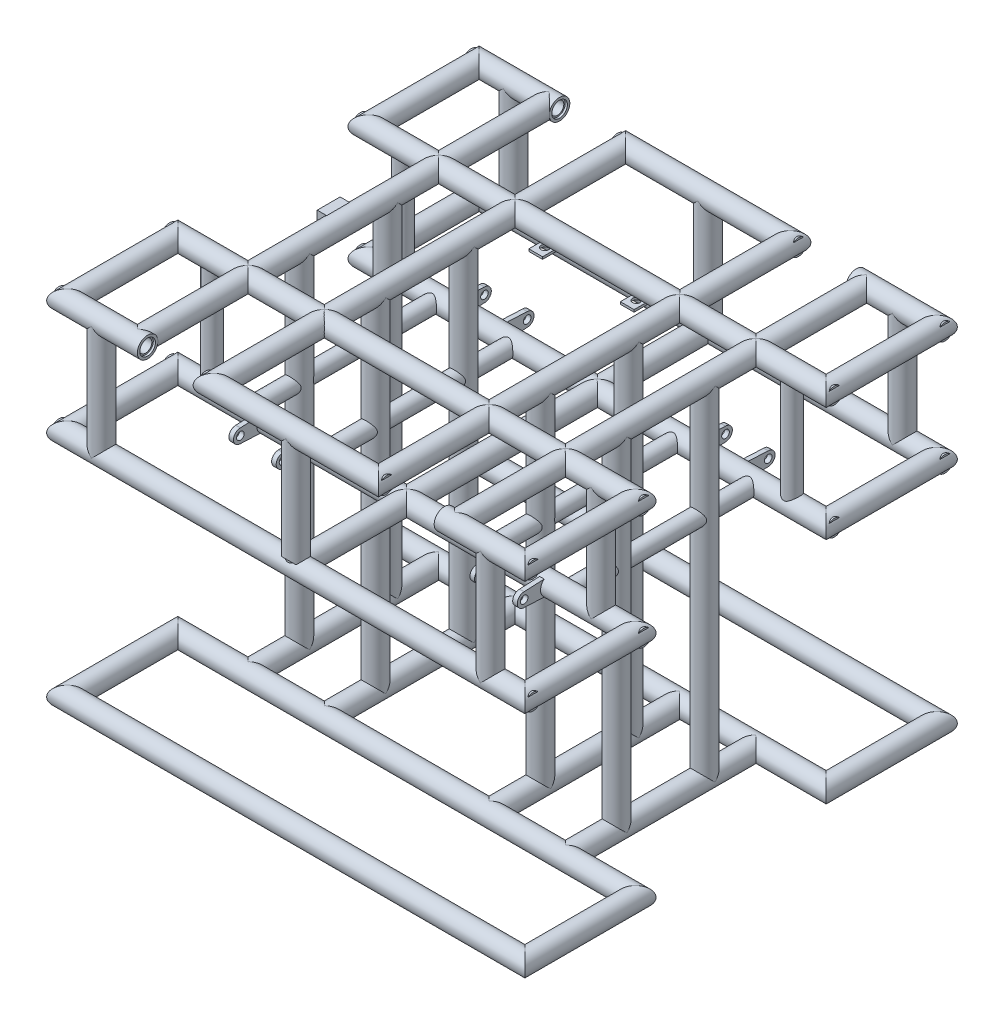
SolidWorks part; units mm, degrees
ref_plane "Front Plane" through (0, 0, 0) normal (0, 0, 1) x (1, 0, 0)
ref_plane "Top Plane" through (0, 0, 0) normal (0, 1, 0) x (1, 0, 0)
ref_plane "Right Plane" through (0, 0, 0) normal (1, 0, 0) x (0, 0, -1)
sketch "Sketch1" plane through (0, 0, 0) normal (0, 1, 0) x (1, 0, 0)
  line L0 (-232.2406, 270) -> (367.7594, 270)
  line L1 (367.7594, 270) -> (367.7594, 125)
  line L2 (367.7594, 125) -> (-232.2406, 125)
  line L3 (-232.2406, 125) -> (-232.2406, 270)
  line L4 (-40.2406, 125) -> (-40.2406, -125)
  line L5 (-324.3697, 0) -> (547.8992, 0) construction
  line L6 (367.7594, -270) -> (367.7594, -125)
  line L7 (367.7594, -125) -> (-232.2406, -125)
  line L8 (-232.2406, -270) -> (367.7594, -270)
  line L9 (-232.2406, -125) -> (-232.2406, -270)
  line L10 (-140.2406, 125) -> (-140.2406, -125)
  line L11 (67.7594, 270) -> (67.7594, -270)
  line L12 (67.7594, 292.9125) -> (67.7594, -328.4913) construction
  line L13 (175.7594, 125) -> (175.7594, -125)
  line L14 (275.7594, 125) -> (275.7594, -125)
  point P6 (-40.2406, 0)
  point P25 (67.7594, 0)
  dimension "D1" = 600
  dimension "D2" = 540
  dimension "D3" = 250
  dimension "D4" = 100
  dimension "D5" = 92
  dimension "D6" = 92
ref_plane "Plane2" through (0, 150, 0) normal (0, 1, 0) x (1, 0, 0)
sketch "Sketch41" plane through (0, 150, 0) normal (0, 1, 0) x (1, 0, 0)
  line L0 (-232.2406, 197.5) -> (367.7594, 197.5) construction
  line L1 (67.7594, 296.3558) -> (67.7594, -365.801) construction
  line L2 (-140.2406, 270) -> (-140.2406, -270)
  line L3 (-40.2406, 270) -> (-40.2406, -270)
  line L4 (367.7594, -270) -> (367.7594, -125)
  line L5 (367.7594, -125) -> (-232.2406, -125)
  line L6 (-232.2406, -125) -> (-232.2406, -270)
  line L7 (-232.2406, -270) -> (367.7594, -270)
  line L8 (367.7594, -270) -> (367.7594, -125)
  line L9 (367.7594, -125) -> (-232.2406, -125)
  line L10 (-232.2406, -125) -> (-232.2406, -270)
  line L11 (-232.2406, -270) -> (-140.2406, -270)
  line L12 (367.7594, 270) -> (-232.2406, 270)
  line L13 (367.7594, 125) -> (367.7594, 270)
  line L14 (-232.2406, 125) -> (367.7594, 125)
  line L15 (-232.2406, 270) -> (-232.2406, 125)
  line L16 (367.7594, 270) -> (275.7594, 270)
  line L17 (367.7594, 125) -> (367.7594, 270)
  line L19 (-232.2406, 270) -> (-232.2406, 125)
  line L20 (275.7594, 270) -> (275.7594, -270)
  line L21 (175.7594, 270) -> (175.7594, -270)
  line L22 (-140.2406, 270) -> (-232.2406, 270)
  line L23 (-232.2406, 125) -> (367.7594, 125)
  line L24 (-140.2406, 125) -> (-140.2406, -125) construction
  line L25 (-40.2406, -270) -> (175.7594, -270)
  line L26 (275.7594, -270) -> (367.7594, -270)
  line L27 (175.7594, 270) -> (-40.2406, 270)
  line L28 (175.7594, 125) -> (175.7594, -125) construction
  line L29 (67.7594, 270) -> (67.7594, -270)
  dimension "D3" = 100
  dimension "D1" = 0
  dimension "D2" = 0
ref_plane "Plane12" through (67.7594, 0, 0) normal (1, 0, 0) x (0, 0, -1)
ref_plane "Plane16" through (0, -300, 0) normal (0, 1, 0) x (1, 0, 0)
sketch "Sketch46" plane through (0, -300, 0) normal (0, 1, 0) x (1, 0, 0)
  line L0 (-140.2406, 125) -> (-140.2406, -125) construction
  line L1 (-40.2406, 125) -> (-40.2406, -125) construction
  line L2 (275.7594, 125) -> (275.7594, -125) construction
  line L3 (175.7594, 125) -> (175.7594, -125) construction
  line L4 (367.7594, -270) -> (367.7594, -125)
  line L5 (367.7594, -125) -> (-232.2406, -125)
  line L6 (-232.2406, -125) -> (-232.2406, -270)
  line L7 (-232.2406, -270) -> (367.7594, -270)
  line L8 (367.7594, -270) -> (367.7594, -125)
  line L9 (367.7594, -125) -> (-232.2406, -125)
  line L10 (-232.2406, -125) -> (-232.2406, -270)
  line L11 (-232.2406, -270) -> (367.7594, -270)
  line L12 (367.7594, 270) -> (-232.2406, 270)
  line L13 (367.7594, 125) -> (367.7594, 270)
  line L14 (-232.2406, 125) -> (367.7594, 125)
  line L15 (-232.2406, 270) -> (-232.2406, 125)
  line L16 (367.7594, 270) -> (-232.2406, 270)
  line L17 (367.7594, 125) -> (367.7594, 270)
  line L18 (-232.2406, 125) -> (367.7594, 125)
  line L19 (-232.2406, 270) -> (-232.2406, 125)
  line L20 (-140.2406, 125) -> (-140.2406, -125)
  line L21 (-40.2406, 125) -> (-40.2406, -125)
  line L22 (275.7594, 125) -> (275.7594, -125)
  line L23 (175.7594, 125) -> (175.7594, -125)
  dimension "D1" = 0
  dimension "D2" = 0
sketch3d "3DSketch1"
  line L2 (-140.2406, 150, -57.7625) -> (-140.2406, -300, -57.7625)
  line L4 (-187.2406, 0, -270) -> (-187.2406, 150, -270)
  line L5 (-232.2406, 0, -270) -> (367.7594, 0, -270) construction
  line L6 (-187.2406, 0, -125) -> (-187.2406, 150, -125)
  line L7 (367.7594, 0, -125) -> (-232.2406, 0, -125) construction
  line L8 (322.7594, 0, -270) -> (322.7594, 150, -270)
  line L9 (322.7594, 0, -125) -> (322.7594, 150, -125)
  line L10 (322.7594, 0, 270) -> (322.7594, 150, 270)
  line L11 (-187.2406, 0, 270) -> (-187.2406, 150, 270)
  line L12 (-187.2406, 0, 125) -> (-187.2406, 150, 125)
  line L13 (-140.2406, 150, 57.7625) -> (-140.2406, -300, 57.7625)
  line L14 (-40.2406, 150, 57.7625) -> (-40.2406, -300, 57.7625)
  line L15 (322.7594, 0, 125) -> (322.7594, 150, 125)
  line L16 (67.7594, 0, -270) -> (67.7594, 150, -270)
  line L17 (67.7594, 0, 270) -> (67.7594, 150, 270)
  line L18 (-232.2406, 0, 270) -> (367.7594, 0, 270) construction
  line L19 (175.7594, 150, -270) -> (-40.2406, 150, -270) construction
  line L20 (-140.2406, 150, -270) -> (-140.2406, 150, 270) construction
  line L21 (-40.2406, 150, 270) -> (175.7594, 150, 270) construction
  line L22 (275.7594, 150, -57.7625) -> (275.7594, -300, -57.7625)
  line L23 (275.7594, 150, 57.7625) -> (275.7594, -300, 57.7625)
  line L24 (175.7594, 150, 57.7625) -> (175.7594, -300, 57.7625)
  line L25 (175.7594, 150, -57.7625) -> (175.7594, -300, -57.7625)
  line L26 (-140.2406, -300, -125) -> (-140.2406, -300, 125) construction
  line L27 (-40.2406, 150, -270) -> (-40.2406, 150, 270) construction
  line L28 (-40.2406, -300, -125) -> (-40.2406, -300, 125) construction
  line L29 (-40.2406, 150, -57.7625) -> (-40.2406, -300, -57.7625)
  line L31 (175.7594, 150, -270) -> (175.7594, 150, 270) construction
  line L32 (175.7594, -300, -125) -> (175.7594, -300, 125) construction
  line L33 (275.7594, 150, -270) -> (275.7594, 150, 270) construction
  line L34 (275.7594, -300, -125) -> (275.7594, -300, 125) construction
  dimension "D1" = 510
  dimension "D2" = 45
other "Circular tube 21.3 X 2.3(1)"
ref_plane "Plane9" through (-232.2406, 0, -270) normal (1, 0, 0) x (0, 0, -1)
sketch "Sketch19" plane through (-232.2406, 0, -270) normal (1, 0, 0) x (0, 0, -1)
  circle A0 centre (0, 0) radius 8.35
  circle A1 centre (0, 0) radius 10.65
  point P3 (0, 0)
  dimension "In_dia" = 16.7
  dimension "Out_dia" = 21.3
other "Circular tube 26.9 X 3.2(1)"
ref_plane "Plane24" through (367.7594, -300, 125) normal (-1, 0, 0) x (0, 0, 1)
sketch "Sketch114" plane through (367.7594, -300, 125) normal (-1, 0, 0) x (0, 0, 1)
  circle A0 centre (0, 0) radius 10.25
  circle A1 centre (0, 0) radius 13.45
  point P3 (0, 0)
  point P5 (0, 0)
  point P6 (0, 0)
  dimension "In_dia" = 20.5
  dimension "Out_dia" = 26.9
ref_plane "Plane14" through (0, 0, -125) normal (0, 0, 1) x (1, 0, 0)
ref_plane "Plane15" through (0, 0, 125) normal (0, 0, 1) x (1, 0, 0)
ref_plane "Plane17" through (275.7594, 0, 0) normal (1, 0, 0) x (0, 0, -1)
sketch "Sketch48" plane through (0, 0, 0) normal (0, 1, 0) x (1, 0, 0)
  line L0 (175.7594, 125) -> (275.7594, 125) construction
  point P6 (250.7594, 125)
  point P7 (200.7594, 125)
  point P8 (225.7594, 125)
  dimension "D1" = 25
  dimension "D2" = 25
ref_plane "Plane18" through (250.7594, 0, 0) normal (1, 0, 0) x (0, 0, -1)
ref_plane "Plane19" through (200.7594, 0, 0) normal (1, 0, 0) x (0, 0, -1)
sketch "Sketch50" plane through (250.7594, 0, 0) normal (1, 0, 0) x (0, 0, -1)
  line L0 (125, 10.65) -> (160, 9)
  line L1 (125, -10.65) -> (160, -9)
  line L2 (125, 10.65) -> (125, 8.35)
  line L3 (125, 0) -> (125, 150) construction
  line L4 (125, -10.65) -> (125, -8.35)
  circle A0 centre (160, 0) radius 5
  arc A1 (160, -9) -> (160, 9) centre (160, 0) ccw
  arc A2 (125, -10.65) -> (125, 10.65) centre (125, 0) ccw construction
  circle A3 centre (125, 0) radius 8.35 construction
  arc A4 (125, 8.35) -> (125, -8.35) centre (125, 0) cw
  dimension "D1" = 18
extrude "Boss-Extrude3" add sketch "Sketch50" along normal blind 6 separate body
sketch "Sketch51" plane through (200.7594, 0, 0) normal (1, 0, 0) x (0, 0, -1)
  line L4 (125, 10.65) -> (125, 8.35)
  line L5 (160, 9) -> (125, 10.65)
  line L6 (125, -10.65) -> (160, -9)
  line L7 (125, -8.35) -> (125, -10.65)
  line L8 (125, 10.65) -> (125, 8.35)
  line L9 (160, 9) -> (125, 10.65)
  line L10 (125, -10.65) -> (160, -9)
  line L11 (125, -8.35) -> (125, -10.65)
  circle A0 centre (160, 0) radius 5
  arc A2 (160, -9) -> (160, 9) centre (160, 0) ccw
  arc A3 (125, -8.35) -> (125, 8.35) centre (125, 0) ccw
  arc A4 (160, -9) -> (160, 9) centre (160, 0) ccw
  arc A5 (125, -8.35) -> (125, 8.35) centre (125, 0) ccw
  dimension "D2" = 10
  dimension "D1" = 0
extrude "Boss-Extrude4" add sketch "Sketch51" against normal blind 6 separate body contours A5 L11 L10 A4 L9 L8 A0
mirror "Mirror1" about plane through (0, 0, 0) normal (0, 0, 1) of "Boss-Extrude3", "Boss-Extrude4"
ref_plane "Plane20" through (67.7594, 0, 0) normal (1, 0, 0) x (0, 0, -1)
mirror "Mirror2" about plane through (67.7594, 0, 0) normal (1, 0, 0) of "Boss-Extrude3", "Boss-Extrude4", "Mirror1"
ref_plane "Plane21" through (6.9325, 0, 0) normal (1, 0, 0) x (0, 0, -1)
sketch "Sketch52" plane through (6.9325, 0, 0) normal (1, 0, 0) x (0, 0, -1)
  line L1 (126, 133.3407) -> (133.6144, 143.7379)
  line L3 (125.0853, 139.3503) -> (122.8812, 136.3407)
  line L4 (-105, 136.3407) -> (-122.8812, 136.3407)
  line L8 (0, -25.4644) -> (0, 192.3915) construction
  line L14 (126, 133.3407) -> (105, 133.3407)
  line L17 (105, 133.3407) -> (105, 136.3407)
  line L18 (105, 136.3407) -> (122.8812, 136.3407)
  line L19 (-105, 133.3407) -> (-105, 136.3407)
  line L20 (-126, 133.3407) -> (-105, 133.3407)
  line L21 (-125.0853, 139.3503) -> (-122.8812, 136.3407)
  line L22 (-126, 133.3407) -> (-133.6144, 143.7379)
  arc A1 (-125, 160.65) -> (-125, 139.35) centre (-125, 150) ccw construction
  arc A4 (-270, 139.35) -> (-270, 160.65) centre (-270, 150) ccw construction
  arc A5 (133.6144, 143.7379) -> (125.0853, 139.3503) centre (124.9615, 150.0749) cw
  arc A6 (-125.0853, 139.3503) -> (-133.6144, 143.7379) centre (-124.9615, 150.0749) cw
  dimension "D1" = 3
  dimension "D2" = 21
extrude "Boss-Extrude5" add sketch "Sketch52" along normal mid plane 18 separate body
ref_plane "Plane22" through (66.9325, 133.3407, 0) normal (-1, 0, 0) x (0, 0, -1)
mirror "Mirror3" about plane through (66.9325, 133.3407, 0) normal (-1, 0, 0) of "Boss-Extrude5"
sketch "Sketch53" plane through (0, 133.3407, 0) normal (0, -1, 0) x (1, 0, 0)
  circle A0 centre (6.9325, -117) radius 5
  circle A1 centre (126.9325, -117) radius 5
  circle A2 centre (6.9325, 117) radius 5
  circle A3 centre (126.9325, 117) radius 5
extrude "Cut-Extrude1" cut sketch "Sketch53" against normal up to surface (3 mm away)
sketch "Sketch59" plane through (0, 0, 0) normal (0, 0, 1) x (1, 0, 0)
  line L0 (-140.2406, 132.5536) -> (-140.2406, 169.276) construction
  line L1 (-140.2406, 140.2648) -> (-159.4756, 140.2648)
  line L2 (-159.4756, 140.2648) -> (-159.4756, 161.5648)
  line L3 (-159.4756, 161.5648) -> (-140.2406, 161.5648)
  arc A2 (-140.2406, 161.5648) -> (-140.2406, 140.2648) centre (-140.2406, 150.9148) ccw
  point P3 (-140.2406, 150.9148)
  dimension "D1" = 10.65
extrude "Boss-Extrude6" add sketch "Sketch59" along normal mid plane 30 separate body
sketch "Sketch60" plane through (-159.4756, 0, 0) normal (-1, 0, 0) x (0, 0, 1)
  line L0 (15, 161.5648) -> (15, 140.2648) construction
  line L1 (15, 140.2648) -> (-15, 140.2648) construction
  circle A1 centre (0, 150.9148) radius 2.9
  point P5 (15, 150.9148)
  point P9 (0, 140.2648)
  dimension "D1" = 5.8
extrude "Cut-Extrude2" cut sketch "Sketch60" against normal blind 8
